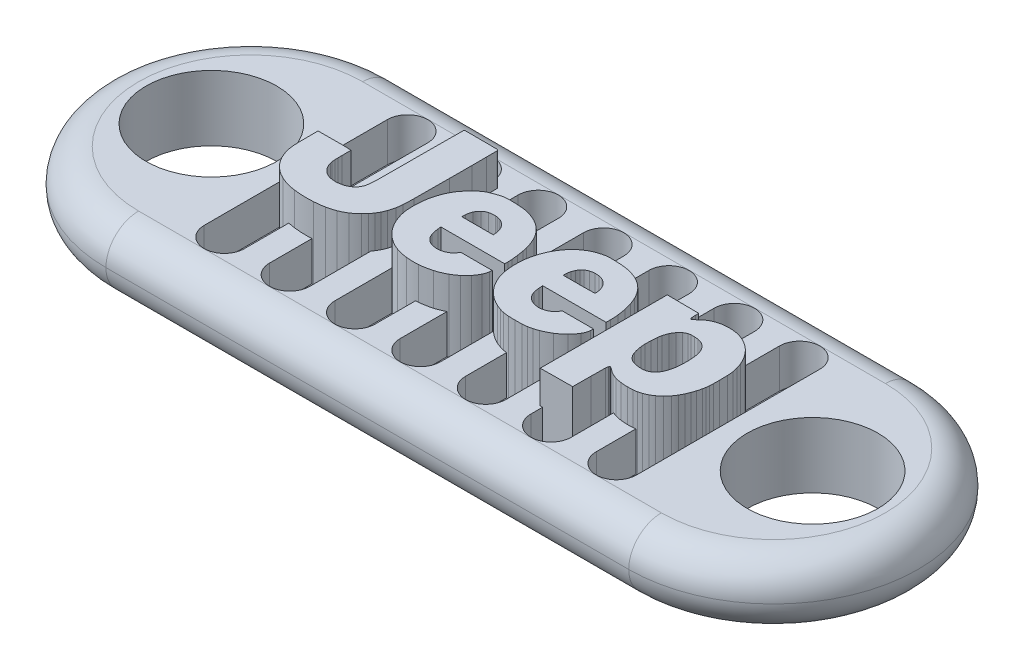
SolidWorks part; units mm, degrees
ref_plane "Front Plane" through (0, 0, 0) normal (0, 0, 1) x (1, 0, 0)
ref_plane "Top Plane" through (0, 0, 0) normal (0, 1, 0) x (1, 0, 0)
ref_plane "Right Plane" through (0, 0, 0) normal (1, 0, 0) x (0, 0, -1)
sketch "Sketch2" plane through (0, 0, 0) normal (0, 1, 0) x (1, 0, 0)
  line L0 (7.1989, 14.0654) -> (7.189, 13.0274)
  line L1 (4.2006, 7.7862) -> (4.2, 8.4725)
  line L2 (4.2, 8.4725) -> (4.01, 8.4933)
  line L3 (2.74, 8.507) -> (1.66, 8.5)
  line L4 (1.66, 8.5) -> (1.6621, 7.5)
  line L5 (9.8308, 13.2169) -> (9.8236, 14.0403)
  line L6 (17.5483, 5.7274) -> (17.5711, 5.92)
  line L7 (17.5711, 5.92) -> (16.371, 5.92)
  line L8 (16.371, 5.92) -> (15.1709, 5.92)
  line L9 (15.1709, 5.92) -> (15.0609, 5.7613)
  line L10 (12.7418, 6.59) -> (12.716, 6.84)
  line L11 (12.716, 6.84) -> (15.158, 6.84)
  line L12 (15.158, 6.84) -> (17.6, 6.84)
  line L13 (17.6, 6.84) -> (17.6, 7.0884)
  line L14 (15.2255, 8.5678) -> (15.2514, 8.32)
  line L15 (15.2514, 8.32) -> (14.0403, 8.32)
  line L16 (14.0403, 8.32) -> (12.8293, 8.32)
  line L17 (12.8293, 8.32) -> (12.8492, 8.5985)
  line L18 (25.3087, 5.7017) -> (25.3312, 5.92)
  line L19 (25.3312, 5.92) -> (24.1309, 5.92)
  line L20 (24.1309, 5.92) -> (22.9306, 5.92)
  line L21 (22.9306, 5.92) -> (22.8245, 5.7597)
  line L22 (20.5304, 6.53) -> (20.5086, 6.84)
  line L23 (20.5086, 6.84) -> (22.9343, 6.84)
  line L24 (22.9343, 6.84) -> (25.36, 6.84)
  line L25 (25.36, 6.84) -> (25.3592, 7.17)
  line L26 (22.9924, 8.3378) -> (22.6472, 8.3288)
  line L27 (21.7922, 8.32) -> (20.589, 8.32)
  line L28 (20.589, 8.32) -> (20.6101, 8.5821)
  line L29 (28.3102, 10.72) -> (28.3, 10.98)
  line L30 (28.3, 10.98) -> (27.09, 10.9906)
  line L31 (27.09, 10.9906) -> (25.88, 11.0012)
  line L32 (25.88, 11.0012) -> (25.88, 6.14)
  line L33 (25.88, 6.14) -> (25.88, 1.2788)
  line L34 (25.88, 1.2788) -> (27.11, 1.2894)
  line L35 (27.11, 1.2894) -> (28.34, 1.3)
  line L36 (28.34, 1.3) -> (28.3505, 2.69)
  arc A0 (7.2104, 14.1047) -> (7.1989, 14.0654) centre (7.2747, 14.0646) ccw
  arc A1 (7.189, 13.0274) -> (7.1809, 11.8681) centre (250.312, 10.7468) ccw
  arc A2 (7.1809, 11.8681) -> (7.1766, 10.5) centre (477.0051, 9.7009) ccw
  arc A3 (7.1686, 7.8738) -> (7.1766, 10.5) centre (-981.6143, 12.1817) ccw
  arc A4 (7.1431, 7.0983) -> (7.1686, 7.8738) centre (-6.4614, 7.9332) ccw
  arc A5 (7.0741, 6.6846) -> (7.1431, 7.0983) centre (5.129, 7.2219) ccw
  arc A6 (6.9231, 6.3707) -> (7.0741, 6.6846) centre (6.1296, 6.9455) ccw
  arc A7 (6.7206, 6.1526) -> (6.9231, 6.3707) centre (5.9288, 7.091) ccw
  arc A8 (6.4704, 5.9881) -> (6.7206, 6.1526) centre (5.9103, 7.1129) ccw
  arc A9 (6.1674, 5.8764) -> (6.4704, 5.9881) centre (5.8079, 7.3185) ccw
  arc A10 (5.8077, 5.8153) -> (6.1674, 5.8764) centre (5.5848, 8.2134) ccw
  arc A11 (5.2709, 5.8503) -> (5.8077, 5.8153) centre (5.6494, 7.5188) ccw
  arc A12 (4.806, 6.0527) -> (5.2709, 5.8503) centre (5.5716, 7.1757) ccw
  arc A13 (4.4574, 6.4056) -> (4.806, 6.0527) centre (5.5342, 7.121) ccw
  arc A14 (4.2544, 6.8741) -> (4.4574, 6.4056) centre (5.661, 7.2052) ccw
  arc A15 (4.2319, 7.0101) -> (4.2544, 6.8741) centre (5.2601, 7.1108) ccw
  arc A16 (4.2152, 7.2223) -> (4.2319, 7.0101) centre (9.7062, 7.5462) ccw
  arc A17 (4.2044, 7.4842) -> (4.2152, 7.2223) centre (11.6842, 7.6628) ccw
  arc A18 (4.2006, 7.7862) -> (4.2044, 7.4842) centre (17.3536, 7.7982) ccw
  arc A19 (4.01, 8.4933) -> (3.8862, 8.5011) centre (3.8615, 7.1337) ccw
  arc A20 (3.8862, 8.5011) -> (3.5586, 8.5059) centre (3.0695, -36.6513) ccw
  arc A21 (3.5586, 8.5059) -> (3.1675, 8.5082) centre (3.1266, -31.3811) ccw
  arc A22 (3.1675, 8.5082) -> (2.74, 8.507) centre (3.1091, -48.4008) ccw
  arc A23 (1.6621, 7.5) -> (1.6747, 6.7835) centre (24.9895, 7.5495) ccw
  arc A24 (1.6747, 6.7835) -> (1.7148, 6.3282) centre (5.8159, 6.9196) ccw
  arc A25 (1.7148, 6.3282) -> (1.7972, 5.9573) centre (4.2165, 6.6889) ccw
  arc A26 (1.7972, 5.9573) -> (1.9431, 5.5513) centre (5.8084, 7.1703) ccw
  arc A27 (1.9431, 5.5513) -> (2.5445, 4.6586) centre (4.4909, 6.6185) ccw
  arc A28 (2.5445, 4.6586) -> (3.4603, 4.0269) centre (4.7558, 6.8852) ccw
  arc A29 (3.4603, 4.0269) -> (4.6767, 3.6842) centre (5.1956, 7.8554) ccw
  arc A30 (4.6767, 3.6842) -> (6.1582, 3.6409) centre (5.6456, 11.4736) ccw
  arc A31 (6.1582, 3.6409) -> (6.9907, 3.7459) centre (5.7022, 10.6092) ccw
  arc A32 (6.9907, 3.7459) -> (7.6832, 3.945) centre (6.2851, 7.5044) ccw
  arc A33 (7.6832, 3.945) -> (8.275, 4.2519) centre (6.5112, 6.9286) ccw
  arc A34 (8.275, 4.2519) -> (8.8035, 4.68) centre (6.3657, 7.1494) ccw
  arc A35 (8.8035, 4.68) -> (9.0649, 4.9635) centre (5.9225, 7.5984) ccw
  arc A36 (9.0649, 4.9635) -> (9.2759, 5.2485) centre (6.8137, 6.8512) ccw
  arc A37 (9.2759, 5.2485) -> (9.445, 5.5478) centre (6.9753, 6.7459) ccw
  arc A38 (9.445, 5.5478) -> (9.5806, 5.8739) centre (6.6945, 6.8822) ccw
  arc A39 (9.5806, 5.8739) -> (9.7229, 6.3852) centre (5.7043, 7.2281) ccw
  arc A40 (9.7229, 6.3852) -> (9.7886, 6.8842) centre (6.473, 7.0669) ccw
  arc A41 (9.7886, 6.8842) -> (9.8139, 7.7027) centre (-7.1419, 7.8173) ccw
  arc A42 (9.8139, 7.7027) -> (9.8287, 10.3757) centre (-1087.4737, 15.1221) ccw
  arc A43 (9.8287, 10.3757) -> (9.834, 12.1155) centre (-670.8311, 13.3211) ccw
  arc A44 (9.834, 12.1155) -> (9.8308, 13.2169) centre (-107.635, 12.3238) ccw
  arc A45 (9.8236, 14.0403) -> (9.8004, 14.0956) centre (9.7443, 14.0395) ccw
  arc A46 (9.8004, 14.0956) -> (9.6933, 14.1404) centre (9.6922, 13.9874) ccw
  arc A47 (9.6933, 14.1404) -> (8.4964, 14.1469) centre (7.4182, -294.0203) ccw
  arc A48 (8.4964, 14.1469) -> (7.2905, 14.1492) centre (7.1906, -358.9684) ccw
  arc A49 (7.2905, 14.1492) -> (7.2104, 14.1047) centre (7.2905, 14.0549) ccw
  arc A50 (13.1619, 11.2374) -> (12.8973, 11.175) centre (13.6026, 8.7799) ccw
  arc A51 (12.8973, 11.175) -> (12.5834, 11.072) centre (14.4234, 5.9921) ccw
  arc A52 (12.5834, 11.072) -> (12.28, 10.9515) centre (14.4006, 6.0553) ccw
  arc A53 (12.28, 10.9515) -> (12.0498, 10.8346) centre (13.1203, 9.0112) ccw
  arc A54 (12.0498, 10.8346) -> (11.7703, 10.6326) centre (12.9708, 9.2659) ccw
  arc A55 (11.7703, 10.6326) -> (11.4368, 10.3146) centre (15.4991, 6.3875) ccw
  arc A56 (11.4368, 10.3146) -> (11.1235, 9.9628) centre (15.5736, 6.3155) ccw
  arc A57 (11.1235, 9.9628) -> (10.9043, 9.6497) centre (13.0733, 8.3647) ccw
  arc A58 (10.9043, 9.6497) -> (10.63, 9.1024) centre (14.662, 7.4236) ccw
  arc A59 (10.63, 9.1024) -> (10.4337, 8.5202) centre (14.7236, 7.398) ccw
  arc A60 (10.4337, 8.5202) -> (10.3156, 7.901) centre (14.9588, 7.3364) ccw
  arc A61 (10.3156, 7.901) -> (10.2749, 7.2434) centre (15.8503, 7.228) ccw
  arc A62 (10.2749, 7.2434) -> (10.2776, 7.0158) centre (17.8728, 7.2225) ccw
  arc A63 (10.2776, 7.0158) -> (10.2872, 6.7836) centre (18.5332, 7.2404) ccw
  arc A64 (10.2872, 6.7836) -> (10.3015, 6.5779) centre (17.6169, 7.1896) ccw
  arc A65 (10.3015, 6.5779) -> (10.3191, 6.445) centre (11.6943, 6.6944) ccw
  arc A66 (10.3191, 6.445) -> (10.5979, 5.538) centre (14.2575, 7.1592) ccw
  arc A67 (10.5979, 5.538) -> (11.0763, 4.7536) centre (13.8215, 6.966) ccw
  arc A68 (11.0763, 4.7536) -> (11.7281, 4.1363) centre (13.6881, 6.8585) ccw
  arc A69 (11.7281, 4.1363) -> (12.5159, 3.7191) centre (13.6345, 6.7841) ccw
  arc A70 (12.5159, 3.7191) -> (13.3999, 3.5094) centre (13.8504, 7.3756) ccw
  arc A71 (13.3999, 3.5094) -> (14.3622, 3.4926) centre (13.9656, 8.3644) ccw
  arc A72 (14.3622, 3.4926) -> (15.3106, 3.6649) centre (13.9644, 8.3793) ccw
  arc A73 (15.3106, 3.6649) -> (16.1535, 4.0152) centre (14.2252, 7.466) ccw
  arc A74 (16.1535, 4.0152) -> (16.6768, 4.3728) centre (14.4299, 7.0996) ccw
  arc A75 (16.6768, 4.3728) -> (17.1093, 4.8076) centre (14.7039, 6.7672) ccw
  arc A76 (17.1093, 4.8076) -> (17.4121, 5.2746) centre (15.1146, 6.4325) ccw
  arc A77 (17.4121, 5.2746) -> (17.5483, 5.7274) centre (16.196, 5.8875) ccw
  arc A78 (14.8491, 5.533) -> (15.0609, 5.7613) centre (14.156, 6.3884) ccw
  arc A79 (14.5746, 5.3635) -> (14.8491, 5.533) centre (14.0524, 6.5162) ccw
  arc A80 (14.2597, 5.2659) -> (14.5746, 5.3635) centre (14.0281, 6.5698) ccw
  arc A81 (13.9293, 5.2486) -> (14.2597, 5.2659) centre (14.0251, 6.5869) ccw
  arc A82 (13.4496, 5.3609) -> (13.9293, 5.2486) centre (14.0407, 6.8058) ccw
  arc A83 (13.0962, 5.6117) -> (13.4496, 5.3609) centre (13.8112, 6.2448) ccw
  arc A84 (12.8636, 6.0175) -> (13.0962, 5.6117) centre (13.9598, 6.3764) ccw
  arc A85 (12.7418, 6.59) -> (12.8636, 6.0175) centre (15.473, 6.8717) ccw
  arc A86 (17.6, 7.0884) -> (17.5834, 7.4317) centre (14.0423, 7.0884) ccw
  arc A87 (17.5834, 7.4317) -> (17.5284, 7.9074) centre (4.6546, 6.1783) ccw
  arc A88 (17.5284, 7.9074) -> (17.4549, 8.3866) centre (4.629, 6.1749) ccw
  arc A89 (17.4549, 8.3866) -> (17.3773, 8.7465) centre (13.1046, 7.6364) ccw
  arc A90 (17.3773, 8.7465) -> (17.0295, 9.6448) centre (13.3221, 7.6929) ccw
  arc A91 (17.0295, 9.6448) -> (16.5094, 10.3454) centre (14.512, 8.3194) ccw
  arc A92 (16.5094, 10.3454) -> (15.8083, 10.848) centre (14.5649, 8.373) ccw
  arc A93 (15.8083, 10.848) -> (14.927, 11.1621) centre (14.0994, 7.4465) ccw
  arc A94 (14.927, 11.1621) -> (14.5522, 11.2204) centre (14.2891, 8.2983) ccw
  arc A95 (14.5522, 11.2204) -> (14.0156, 11.256) centre (13.5287, -0.1487) ccw
  arc A96 (14.0156, 11.256) -> (13.487, 11.2667) centre (13.5134, -0.5075) ccw
  arc A97 (13.487, 11.2667) -> (13.1619, 11.2374) centre (13.4912, 9.4008) ccw
  arc A98 (14.7889, 9.4052) -> (14.5275, 9.5659) centre (14.1033, 8.5826) ccw
  arc A99 (15.0021, 9.1732) -> (14.7889, 9.4052) centre (14.0273, 8.4914) ccw
  arc A100 (15.1515, 8.887) -> (15.0021, 9.1732) centre (13.9765, 8.4559) ccw
  arc A101 (15.2255, 8.5678) -> (15.1515, 8.887) centre (13.9053, 8.4298) ccw
  arc A102 (12.9612, 9.0617) -> (12.8492, 8.5985) centre (14.2883, 8.4955) ccw
  arc A103 (13.2133, 9.4104) -> (12.9612, 9.0617) centre (13.8569, 8.6795) ccw
  arc A104 (13.5899, 9.6151) -> (13.2133, 9.4104) centre (13.8512, 8.686) ccw
  arc A105 (14.06, 9.6647) -> (13.5899, 9.6151) centre (13.9702, 8.2628) ccw
  arc A106 (14.181, 9.6519) -> (14.06, 9.6647) centre (13.9657, 8.1932) ccw
  arc A107 (14.3128, 9.6283) -> (14.181, 9.6519) centre (13.8648, 7.5089) ccw
  arc A108 (14.4358, 9.5982) -> (14.3128, 9.6283) centre (13.8958, 7.6557) ccw
  arc A109 (14.5275, 9.5659) -> (14.4358, 9.5982) centre (14.2445, 8.9098) ccw
  arc A110 (20.9266, 11.238) -> (20.1553, 11.0011) centre (21.5212, 7.9293) ccw
  arc A111 (20.1553, 11.0011) -> (19.4846, 10.5913) centre (21.3875, 8.23) ccw
  arc A112 (19.4846, 10.5913) -> (18.9239, 10.0095) centre (21.5079, 8.0805) ccw
  arc A113 (18.9239, 10.0095) -> (18.4776, 9.2645) centre (22.3574, 7.4464) ccw
  arc A114 (18.4776, 9.2645) -> (18.2819, 8.7757) centre (22.6335, 7.317) ccw
  arc A115 (18.2819, 8.7757) -> (18.1459, 8.273) centre (22.4487, 7.379) ccw
  arc A116 (18.1459, 8.273) -> (18.0664, 7.7395) centre (22.7837, 7.3094) ccw
  arc A117 (18.0664, 7.7395) -> (18.04, 7.1584) centre (24.4395, 7.1584) ccw
  arc A118 (18.04, 7.1584) -> (18.1753, 6.0867) centre (22.3513, 7.1584) ccw
  arc A119 (18.1753, 6.0867) -> (18.5723, 5.1399) centre (21.5971, 6.9648) ccw
  arc A120 (18.5723, 5.1399) -> (19.2115, 4.3708) centre (21.4259, 6.8616) ccw
  arc A121 (19.2115, 4.3708) -> (20.0551, 3.8184) centre (21.4993, 6.9441) ccw
  arc A122 (20.0551, 3.8184) -> (20.4487, 3.6591) centre (21.904, 7.8201) ccw
  arc A123 (20.4487, 3.6591) -> (20.8016, 3.5648) centre (21.2505, 5.9516) ccw
  arc A124 (20.8016, 3.5648) -> (21.1986, 3.5167) centre (21.367, 6.5708) ccw
  arc A125 (21.1986, 3.5167) -> (21.74, 3.5015) centre (21.75, 13.5192) ccw
  arc A126 (21.74, 3.5015) -> (22.2573, 3.5125) centre (21.7516, 15.175) ccw
  arc A127 (22.2573, 3.5125) -> (22.6374, 3.5495) centre (22.1035, 7.0606) ccw
  arc A128 (22.6374, 3.5495) -> (22.9758, 3.6229) centre (22.2204, 6.2917) ccw
  arc A129 (22.9758, 3.6229) -> (23.3535, 3.7469) centre (21.6698, 8.237) ccw
  arc A130 (23.3535, 3.7469) -> (24.0723, 4.1056) centre (21.9963, 7.3661) ccw
  arc A131 (24.0723, 4.1056) -> (24.6889, 4.6003) centre (22.1239, 7.1657) ccw
  arc A132 (24.6889, 4.6003) -> (25.1261, 5.1577) centre (22.6033, 6.6862) ccw
  arc A133 (25.1261, 5.1577) -> (25.3087, 5.7017) centre (24.0065, 5.8361) ccw
  arc A134 (22.6374, 5.549) -> (22.8245, 5.7597) centre (21.992, 6.3107) ccw
  arc A135 (22.3871, 5.383) -> (22.6374, 5.549) centre (21.8085, 6.5272) ccw
  arc A136 (22.0981, 5.2762) -> (22.3871, 5.383) centre (21.7779, 6.5876) ccw
  arc A137 (21.797, 5.24) -> (22.0981, 5.2762) centre (21.797, 6.5097) ccw
  arc A138 (21.7059, 5.2457) -> (21.797, 5.24) centre (21.797, 5.9656) ccw
  arc A139 (21.5851, 5.2643) -> (21.7059, 5.2457) centre (21.9924, 7.5108) ccw
  arc A140 (21.4568, 5.2911) -> (21.5851, 5.2643) centre (22.0284, 7.7092) ccw
  arc A141 (21.3404, 5.3228) -> (21.4568, 5.2911) centre (21.8685, 7.0326) ccw
  arc A142 (21.0128, 5.4854) -> (21.3404, 5.3228) centre (21.6765, 6.4112) ccw
  arc A143 (20.7672, 5.7388) -> (21.0128, 5.4854) centre (21.5905, 6.2912) ccw
  arc A144 (20.6068, 6.0873) -> (20.7672, 5.7388) centre (21.7685, 6.4106) ccw
  arc A145 (20.5304, 6.53) -> (20.6068, 6.0873) centre (22.7627, 6.6873) ccw
  arc A146 (25.3592, 7.17) -> (25.3246, 7.7853) centre (19.6274, 7.1564) ccw
  arc A147 (25.3246, 7.7853) -> (25.2241, 8.405) centre (19.1887, 7.108) ccw
  arc A148 (25.2241, 8.405) -> (25.0654, 8.9925) centre (19.5279, 7.1809) ccw
  arc A149 (25.0654, 8.9925) -> (24.8562, 9.511) centre (21.1143, 7.6999) ccw
  arc A150 (24.8562, 9.511) -> (24.4759, 10.1211) centre (21.8143, 8.0387) ccw
  arc A151 (24.4759, 10.1211) -> (23.9958, 10.5942) centre (22.4103, 8.5049) ccw
  arc A152 (23.9958, 10.5942) -> (23.4009, 10.9375) centre (22.3413, 8.4141) ccw
  arc A153 (23.4009, 10.9375) -> (22.6802, 11.1623) centre (21.8617, 7.272) ccw
  arc A154 (22.6802, 11.1623) -> (22.2898, 11.2213) centre (21.9741, 7.8063) ccw
  arc A155 (22.2898, 11.2213) -> (21.7623, 11.257) centre (21.2976, 0.4878) ccw
  arc A156 (21.7623, 11.257) -> (21.2479, 11.2672) centre (21.2855, 0.2072) ccw
  arc A157 (21.2479, 11.2672) -> (20.9266, 11.238) centre (21.2542, 9.4149) ccw
  arc A158 (22.584, 9.3827) -> (22.3431, 9.5402) centre (21.8324, 8.4964) ccw
  arc A159 (22.7765, 9.1719) -> (22.584, 9.3827) centre (21.8565, 8.5248) ccw
  arc A160 (22.9145, 8.9131) -> (22.7765, 9.1719) centre (21.8003, 8.4853) ccw
  arc A161 (22.9946, 8.6139) -> (22.9145, 8.9131) centre (21.5339, 8.383) ccw
  arc A162 (23.0075, 8.5221) -> (22.9946, 8.6139) centre (20.4172, 8.2066) ccw
  arc A163 (23.0154, 8.4399) -> (23.0075, 8.5221) centre (21.3706, 8.3227) ccw
  arc A164 (23.0191, 8.3717) -> (23.0154, 8.4399) centre (21.0658, 8.301) ccw
  arc A165 (23.0134, 8.35) -> (23.0191, 8.3717) centre (22.9799, 8.3703) ccw
  arc A166 (22.9924, 8.3378) -> (23.0134, 8.35) centre (22.9917, 8.3632) ccw
  arc A167 (22.2547, 8.3222) -> (22.6472, 8.3288) centre (22.0139, 34.1109) ccw
  arc A168 (21.7922, 8.32) -> (22.2547, 8.3222) centre (21.7922, 57.847) ccw
  arc A169 (20.6569, 8.8437) -> (20.6101, 8.5821) centre (21.9786, 8.4723) ccw
  arc A170 (20.7538, 9.0972) -> (20.6569, 8.8437) centre (22.0915, 8.4406) ccw
  arc A171 (20.8868, 9.3129) -> (20.7538, 9.0972) centre (21.9359, 8.517) ccw
  arc A172 (21.0414, 9.461) -> (20.8868, 9.3129) centre (21.4293, 8.9013) ccw
  arc A173 (21.331, 9.6026) -> (21.0414, 9.461) centre (21.651, 8.5814) ccw
  arc A174 (21.6727, 9.6656) -> (21.331, 9.6026) centre (21.7598, 8.234) ccw
  arc A175 (22.0242, 9.6448) -> (21.6727, 9.6656) centre (21.7622, 8.1947) ccw
  arc A176 (22.3431, 9.5402) -> (22.0242, 9.6448) centre (21.8076, 8.4456) ccw
  arc A177 (30.0216, 11.1555) -> (29.6294, 11.071) centre (30.4501, 8.2139) ccw
  arc A178 (29.6294, 11.071) -> (29.2869, 10.9391) centre (30.2066, 9.0619) ccw
  arc A179 (29.2869, 10.9391) -> (28.976, 10.7508) centre (30.1861, 9.1035) ccw
  arc A180 (28.976, 10.7508) -> (28.6788, 10.4977) centre (30.5832, 8.563) ccw
  arc A181 (28.5906, 10.4143) -> (28.6788, 10.4977) centre (26.5721, 12.638) ccw
  arc A182 (28.5085, 10.3439) -> (28.5906, 10.4143) centre (27.3186, 11.8156) ccw
  arc A183 (28.4382, 10.2895) -> (28.5085, 10.3439) centre (27.158, 12.0142) ccw
  arc A184 (28.4096, 10.28) -> (28.4382, 10.2895) centre (28.4096, 10.328) ccw
  arc A185 (28.3696, 10.3037) -> (28.4096, 10.28) centre (28.4096, 10.3255) ccw
  arc A186 (28.3419, 10.3773) -> (28.3696, 10.3037) centre (28.6196, 10.4401) ccw
  arc A187 (28.3225, 10.5063) -> (28.3419, 10.3773) centre (29.2111, 10.5736) ccw
  arc A188 (28.3102, 10.72) -> (28.3225, 10.5063) centre (34.2064, 10.952) ccw
  arc A189 (28.3622, 3.7777) -> (28.3505, 2.69) centre (199.4795, 1.3949) ccw
  arc A190 (28.3963, 4.0087) -> (28.3622, 3.7777) centre (29.2468, 3.7653) ccw
  arc A191 (28.4899, 4.0504) -> (28.3963, 4.0087) centre (28.4606, 3.9903) ccw
  arc A192 (28.7007, 3.9139) -> (28.4899, 4.0504) centre (28.0303, 3.1094) ccw
  arc A193 (28.7007, 3.9139) -> (29.0511, 3.6791) centre (29.9999, 5.473) ccw
  arc A194 (29.0511, 3.6791) -> (29.4507, 3.515) centre (30.0934, 5.6497) ccw
  arc A195 (29.4507, 3.515) -> (29.915, 3.4181) centre (30.2405, 6.1384) ccw
  arc A196 (29.915, 3.4181) -> (30.46, 3.3843) centre (30.4835, 8.1697) ccw
  arc A197 (30.46, 3.3843) -> (30.8641, 3.3963) centre (30.4886, 9.2193) ccw
  arc A198 (30.8641, 3.3963) -> (31.1741, 3.4393) centre (30.7268, 5.5256) ccw
  arc A199 (31.1741, 3.4393) -> (31.4635, 3.5253) centre (30.7663, 5.3417) ccw
  arc A200 (31.4635, 3.5253) -> (31.8, 3.6716) centre (29.9553, 7.4544) ccw
  arc A201 (31.8, 3.6716) -> (32.1099, 3.8635) centre (31.0062, 5.2993) ccw
  arc A202 (32.1099, 3.8635) -> (32.4393, 4.1494) centre (29.8684, 6.7795) ccw
  arc A203 (32.4393, 4.1494) -> (32.7378, 4.4777) centre (29.8026, 6.8468) ccw
  arc A204 (32.7378, 4.4777) -> (32.9544, 4.8) centre (31.0087, 5.8734) ccw
  arc A205 (32.9544, 4.8) -> (33.1123, 5.1125) centre (28.7167, 7.1378) ccw
  arc A206 (33.1123, 5.1125) -> (33.2484, 5.4377) centre (28.5949, 7.1939) ccw
  arc A207 (33.2484, 5.4377) -> (33.3615, 5.7727) centre (28.5655, 7.205) ccw
  arc A208 (33.3615, 5.7727) -> (33.4506, 6.1147) centre (28.5774, 7.2015) ccw
  arc A209 (33.4506, 6.1147) -> (33.4954, 6.3541) centre (29.9644, 6.8922) ccw
  arc A210 (33.4954, 6.3541) -> (33.5209, 6.5831) centre (30.6648, 6.7854) ccw
  arc A211 (33.5209, 6.5831) -> (33.5335, 6.8738) centre (28.2601, 6.9558) ccw
  arc A212 (33.5335, 6.8738) -> (33.5374, 7.34) centre (1.3645, 7.3741) ccw
  arc A213 (33.5374, 7.34) -> (33.5236, 7.9743) centre (19.6169, 7.3548) ccw
  arc A214 (33.5236, 7.9743) -> (33.4769, 8.4402) centre (29.2899, 7.7857) ccw
  arc A215 (33.4769, 8.4402) -> (33.3864, 8.8411) centre (30.4457, 7.9664) ccw
  arc A216 (33.3864, 8.8411) -> (33.2371, 9.2608) centre (29.3323, 7.6352) ccw
  arc A217 (33.2371, 9.2608) -> (32.6996, 10.1421) centre (30.1141, 7.9607) ccw
  arc A218 (32.6996, 10.1421) -> (31.9365, 10.7864) centre (30.427, 8.2246) ccw
  arc A219 (31.9365, 10.7864) -> (31.0158, 11.1336) centre (30.4762, 8.3082) ccw
  arc A220 (31.0158, 11.1336) -> (30.0216, 11.1555) centre (30.4536, 8.1899) ccw
  arc A221 (30.5878, 8.9478) -> (30.2053, 9.1806) centre (29.8493, 8.1651) ccw
  arc A222 (30.8539, 8.5742) -> (30.5878, 8.9478) centre (29.7774, 8.089) ccw
  arc A223 (31.0071, 8.0342) -> (30.8539, 8.5742) centre (29.1073, 7.7869) ccw
  arc A224 (31.053, 7.3) -> (31.0071, 8.0342) centre (25.5624, 7.3256) ccw
  arc A225 (31.0192, 6.6478) -> (31.053, 7.3) centre (24.1225, 7.3324) ccw
  arc A226 (30.9211, 6.1273) -> (31.0192, 6.6478) centre (27.9971, 6.9478) ccw
  arc A227 (30.7566, 5.7182) -> (30.9211, 6.1273) centre (28.9638, 6.6765) ccw
  arc A228 (30.5215, 5.4061) -> (30.7566, 5.7182) centre (29.6387, 6.3158) ccw
  arc A229 (30.339, 5.264) -> (30.5215, 5.4061) centre (29.7784, 6.1718) ccw
  arc A230 (30.1403, 5.1743) -> (30.339, 5.264) centre (29.8953, 5.9825) ccw
  arc A231 (29.9039, 5.131) -> (30.1403, 5.1743) centre (29.831, 6.1945) ccw
  arc A232 (29.6056, 5.1284) -> (29.9039, 5.131) centre (29.7336, 7.6166) ccw
  arc A233 (29.0784, 5.2345) -> (29.6056, 5.1284) centre (29.6998, 6.9594) ccw
  arc A234 (28.7023, 5.4852) -> (29.0784, 5.2345) centre (29.3979, 6.1214) ccw
  arc A235 (28.455, 5.909) -> (28.7023, 5.4852) centre (29.5598, 6.2695) ccw
  arc A236 (28.3146, 6.54) -> (28.455, 5.909) centre (31.6486, 6.9511) ccw
  arc A237 (28.2895, 6.9043) -> (28.3146, 6.54) centre (31.6739, 6.9542) ccw
  arc A238 (28.2958, 7.3568) -> (28.2895, 6.9043) centre (36.1863, 7.0207) ccw
  arc A239 (28.3268, 7.7946) -> (28.2958, 7.3568) centre (36.0636, 7.026) ccw
  arc A240 (28.3811, 8.1025) -> (28.3268, 7.7946) centre (30.3901, 7.5896) ccw
  arc A241 (28.5204, 8.499) -> (28.3811, 8.1025) centre (30.7021, 7.51) ccw
  arc A242 (28.7182, 8.8295) -> (28.5204, 8.499) centre (30.0664, 7.7981) ccw
  arc A243 (28.9617, 9.0751) -> (28.7182, 8.8295) centre (29.7935, 8.0069) ccw
  arc A244 (29.2364, 9.2205) -> (28.9617, 9.0751) centre (29.5102, 8.3708) ccw
  arc A245 (29.437, 9.259) -> (29.2364, 9.2205) centre (29.494, 8.4208) ccw
  arc A246 (29.7061, 9.2626) -> (29.437, 9.259) centre (29.6048, 6.7953) ccw
  arc A247 (29.9817, 9.2362) -> (29.7061, 9.2626) centre (29.6018, 6.7225) ccw
  arc A248 (30.2053, 9.1806) -> (29.9817, 9.2362) centre (29.7975, 8.0175) ccw
extrude "Boss-Extrude1" add sketch "Sketch2" along normal blind 2.5
sketch "Sketch3" plane through (0, 0, 0) normal (0, -1, 0) x (1, 0, 0)
  line L0 (1.6656, -7.1417) -> (33.5341, -7.6572) construction
  line L1 (-2.4001, -7.3995) -> (37.5999, -7.3995) construction
  line L2 (-2.4001, 3.6706) -> (37.5999, 3.6706)
  line L3 (-2.4001, -18.4695) -> (37.5999, -18.4695)
  line L4 (0, 0) -> (7.3825, 0) construction
  line L5 (17.5999, -14.4097) -> (17.5999, -0.3893) construction
  line L6 (16.057, -14.4097) -> (16.057, -10.7065)
  line L7 (19.1428, -14.4097) -> (19.1428, -10.2724)
  line L8 (24.1428, -14.4097) -> (24.1428, -10.474)
  line L9 (21.057, -14.4097) -> (21.057, -11.2567)
  line L10 (22.5999, -14.4097) -> (22.5999, -0.3893) construction
  line L11 (29.1428, -14.4097) -> (29.1428, -10.8612)
  line L12 (26.057, -14.4097) -> (26.057, -10.9996)
  line L13 (27.5999, -14.4097) -> (27.5999, -0.3893) construction
  line L14 (34.1428, -14.4097) -> (34.1428, -0.3893)
  line L15 (31.057, -14.4097) -> (31.057, -11.1254)
  line L16 (32.5999, -14.4097) -> (32.5999, -0.3893) construction
  line L17 (12.5999, -14.4097) -> (12.5999, -0.3893) construction
  line L18 (11.057, -14.4097) -> (11.057, -9.878)
  line L19 (14.1428, -14.4097) -> (14.1428, -11.2499)
  line L20 (7.5999, -14.4097) -> (7.5999, -0.3893) construction
  line L21 (6.057, -14.4097) -> (6.057, -5.8516)
  line L22 (9.1428, -14.4097) -> (9.1428, -14.144)
  line L23 (2.5999, -14.4097) -> (2.5999, -0.3893) construction
  line L24 (1.057, -14.4097) -> (1.057, -0.3893)
  line L25 (4.1428, -14.4097) -> (4.1428, -8.4787)
  line L26 (28.3102, -10.72) -> (28.3, -10.98) construction
  line L27 (28.3, -10.98) -> (25.88, -11.0012) construction
  line L29 (4.1428, -3.786) -> (4.1428, -0.3893)
  line L30 (6.057, -3.6349) -> (6.057, -0.3893)
  line L31 (9.1428, -5.0605) -> (9.1428, -0.3893)
  line L32 (7.189, -13.0274) -> (7.1989, -14.0654)
  line L33 (4.2, -8.4725) -> (4.2006, -7.7862)
  line L34 (4.01, -8.4933) -> (4.2, -8.4725)
  line L35 (1.66, -8.5) -> (2.74, -8.507)
  line L36 (1.6621, -7.5) -> (1.66, -8.5)
  line L37 (9.8236, -14.0402) -> (9.8308, -13.2169)
  line L38 (7.189, -13.0274) -> (7.1989, -14.0654)
  line L40 (4.01, -8.4933) -> (4.1428, -8.4787)
  line L41 (1.66, -8.5) -> (2.74, -8.507)
  line L42 (1.6621, -7.5) -> (1.66, -8.5)
  line L44 (25.88, -1.2788) -> (28.34, -1.3) construction
  line L45 (28.34, -1.3) -> (28.3505, -2.69) construction
  line L47 (25.3312, -5.92) -> (22.9306, -5.92) construction
  line L48 (22.9306, -5.92) -> (22.8245, -5.7597) construction
  line L50 (20.5086, -6.84) -> (25.36, -6.84) construction
  line L51 (11.057, -4.7778) -> (11.057, -0.3893)
  line L52 (16.057, -6.84) -> (16.057, -5.92)
  line L53 (16.057, -6.84) -> (17.6, -6.84)
  line L54 (12.8492, -8.5985) -> (12.8293, -8.32) construction
  line L56 (12.8293, -8.32) -> (15.2514, -8.32) construction
  line L57 (12.8492, -8.5985) -> (12.8293, -8.32)
  line L59 (12.8293, -8.32) -> (14.1428, -8.32)
  line L60 (14.1428, -9.6571) -> (14.1428, -8.32)
  line L61 (14.1428, -6.84) -> (14.1428, -5.2504)
  line L62 (16.057, -3.963) -> (16.057, -0.3893)
  line L64 (17.5483, -5.7274) -> (17.5711, -5.92) construction
  line L65 (17.5711, -5.92) -> (15.1709, -5.92) construction
  line L67 (12.7418, -6.59) -> (12.716, -6.84) construction
  line L68 (12.716, -6.84) -> (17.6, -6.84) construction
  line L69 (17.6, -6.84) -> (17.6, -7.0884) construction
  line L70 (28.3102, -10.72) -> (28.3, -10.98)
  line L71 (28.3, -10.98) -> (26.057, -10.9996)
  line L73 (26.057, -1.2804) -> (28.34, -1.3)
  line L74 (28.34, -1.3) -> (28.3505, -2.69)
  line L76 (24.1428, -5.92) -> (22.9306, -5.92)
  line L77 (22.9306, -5.92) -> (22.8245, -5.7597)
  line L79 (21.057, -6.84) -> (24.1428, -6.84)
  line L81 (17.5483, -5.7274) -> (17.5711, -5.92)
  line L82 (17.5711, -5.92) -> (16.057, -5.92)
  line L84 (12.7418, -6.59) -> (12.716, -6.84)
  line L85 (12.716, -6.84) -> (14.1428, -6.84)
  line L86 (17.6, -6.84) -> (17.6, -7.0884)
  line L87 (14.1428, -3.4797) -> (14.1428, -0.3893)
  line L88 (19.1428, -4.4337) -> (19.1428, -0.3893)
  line L89 (21.057, -3.5278) -> (21.057, -0.3893)
  line L90 (24.1428, -4.1516) -> (24.1428, -0.3893)
  line L92 (24.1428, -6.84) -> (24.1428, -5.92)
  line L93 (21.057, -6.84) -> (21.057, -5.4553)
  line L94 (22.6472, -8.3288) -> (22.9924, -8.3378) construction
  line L95 (20.589, -8.32) -> (21.7922, -8.32) construction
  line L97 (22.6472, -8.3288) -> (22.9924, -8.3378)
  line L98 (21.057, -8.32) -> (21.7922, -8.32)
  line L99 (21.057, -9.4716) -> (21.057, -8.32)
  line L100 (29.1428, -9.1844) -> (29.1428, -5.2127)
  line L101 (29.1428, -3.6332) -> (29.1428, -0.3893)
  line L102 (26.057, -1.2804) -> (26.057, -0.3893)
  line L103 (31.057, -3.4176) -> (31.057, -0.3893)
  arc A0 (1.6747, -6.7835) -> (1.6621, -7.5) centre (24.9895, -7.5495) ccw construction
  arc A1 (33.5236, -7.9743) -> (33.5374, -7.34) centre (19.6169, -7.3548) ccw construction
  arc A2 (-2.4001, 3.6706) -> (-2.4001, -18.4695) centre (-2.4001, -7.3995) ccw
  arc A3 (37.5999, -18.4695) -> (37.5999, 3.6706) centre (37.5999, -7.3995) ccw
  circle A4 centre (-5.4001, -7.3995) radius 5
  circle A5 centre (40.5999, -7.3995) radius 5
  arc A6 (16.057, -14.4097) -> (19.1428, -14.4097) centre (17.5999, -14.4097) ccw
  arc A7 (19.1428, -0.3893) -> (16.057, -0.3893) centre (17.5999, -0.3893) ccw
  arc A8 (21.057, -14.4097) -> (24.1428, -14.4097) centre (22.5999, -14.4097) ccw
  arc A9 (24.1428, -0.3893) -> (21.057, -0.3893) centre (22.5999, -0.3893) ccw
  arc A10 (26.057, -14.4097) -> (29.1428, -14.4097) centre (27.5999, -14.4097) ccw
  arc A11 (29.1428, -0.3893) -> (26.057, -0.3893) centre (27.5999, -0.3893) ccw
  arc A12 (31.057, -14.4097) -> (34.1428, -14.4097) centre (32.5999, -14.4097) ccw
  arc A13 (34.1428, -0.3893) -> (31.057, -0.3893) centre (32.5999, -0.3893) ccw
  arc A14 (11.057, -14.4097) -> (14.1428, -14.4097) centre (12.5999, -14.4097) ccw
  arc A15 (14.1428, -0.3893) -> (11.057, -0.3893) centre (12.5999, -0.3893) ccw
  arc A16 (6.057, -14.4097) -> (9.1428, -14.4097) centre (7.5999, -14.4097) ccw
  arc A17 (9.1428, -0.3893) -> (6.057, -0.3893) centre (7.5999, -0.3893) ccw
  arc A18 (1.057, -14.4097) -> (4.1428, -14.4097) centre (2.5999, -14.4097) ccw
  arc A19 (4.1428, -0.3893) -> (1.057, -0.3893) centre (2.5999, -0.3893) ccw
  arc A26 (28.976, -10.7508) -> (29.2869, -10.9391) centre (30.1861, -9.1035) ccw construction
  arc A27 (28.6788, -10.4977) -> (28.976, -10.7508) centre (30.5832, -8.563) ccw construction
  arc A28 (28.6788, -10.4977) -> (28.5906, -10.4143) centre (26.5721, -12.638) ccw construction
  arc A29 (28.5906, -10.4143) -> (28.5085, -10.3439) centre (27.3186, -11.8156) ccw construction
  arc A30 (28.5085, -10.3439) -> (28.4382, -10.2895) centre (27.158, -12.0142) ccw construction
  arc A31 (28.4382, -10.2895) -> (28.4096, -10.28) centre (28.4096, -10.328) ccw construction
  arc A32 (28.4096, -10.28) -> (28.3696, -10.3037) centre (28.4096, -10.3255) ccw construction
  arc A33 (28.3696, -10.3037) -> (28.3419, -10.3773) centre (28.6196, -10.4401) ccw construction
  arc A34 (28.3419, -10.3773) -> (28.3225, -10.5063) centre (29.2111, -10.5736) ccw construction
  arc A35 (28.3225, -10.5063) -> (28.3102, -10.72) centre (34.2064, -10.952) ccw construction
  arc A36 (28.3505, -2.69) -> (28.3622, -3.7777) centre (199.4795, -1.3949) ccw construction
  arc A37 (28.3622, -3.7777) -> (28.3963, -4.0087) centre (29.2468, -3.7653) ccw construction
  arc A38 (28.3963, -4.0087) -> (28.4899, -4.0504) centre (28.4606, -3.9903) ccw construction
  arc A39 (28.4899, -4.0504) -> (28.7007, -3.9139) centre (28.0303, -3.1094) ccw construction
  arc A40 (29.0511, -3.6791) -> (28.7007, -3.9139) centre (29.9999, -5.473) ccw construction
  arc A41 (29.4507, -3.515) -> (29.0511, -3.6791) centre (30.0934, -5.6497) ccw construction
  arc A45 (31.1741, -3.4393) -> (30.8641, -3.3963) centre (30.7268, -5.5256) ccw construction
  arc A46 (31.4635, -3.5253) -> (31.1741, -3.4393) centre (30.7663, -5.3417) ccw construction
  arc A47 (31.8, -3.6716) -> (31.4635, -3.5253) centre (29.9553, -7.4544) ccw construction
  arc A48 (32.1099, -3.8635) -> (31.8, -3.6716) centre (31.0062, -5.2993) ccw construction
  arc A49 (32.4393, -4.1494) -> (32.1099, -3.8635) centre (29.8684, -6.7795) ccw construction
  arc A50 (32.7378, -4.4777) -> (32.4393, -4.1494) centre (29.8026, -6.8468) ccw construction
  arc A51 (32.9544, -4.8) -> (32.7378, -4.4777) centre (31.0087, -5.8734) ccw construction
  arc A52 (33.1123, -5.1125) -> (32.9544, -4.8) centre (28.7167, -7.1378) ccw construction
  arc A53 (33.2484, -5.4377) -> (33.1123, -5.1125) centre (28.5949, -7.1939) ccw construction
  arc A54 (33.3615, -5.7727) -> (33.2484, -5.4377) centre (28.5655, -7.205) ccw construction
  arc A55 (33.4506, -6.1147) -> (33.3615, -5.7727) centre (28.5774, -7.2015) ccw construction
  arc A56 (33.4954, -6.3541) -> (33.4506, -6.1147) centre (29.9644, -6.8922) ccw construction
  arc A57 (33.5209, -6.5831) -> (33.4954, -6.3541) centre (30.6648, -6.7854) ccw construction
  arc A58 (33.5335, -6.8738) -> (33.5209, -6.5831) centre (28.2601, -6.9558) ccw construction
  arc A59 (33.5374, -7.34) -> (33.5335, -6.8738) centre (1.3645, -7.3741) ccw construction
  arc A60 (33.4769, -8.4402) -> (33.5236, -7.9743) centre (29.2899, -7.7857) ccw construction
  arc A61 (33.3864, -8.8411) -> (33.4769, -8.4402) centre (30.4457, -7.9664) ccw construction
  arc A62 (33.2371, -9.2608) -> (33.3864, -8.8411) centre (29.3323, -7.6352) ccw construction
  arc A63 (32.6996, -10.1421) -> (33.2371, -9.2608) centre (30.1141, -7.9607) ccw construction
  arc A64 (31.9365, -10.7864) -> (32.6996, -10.1421) centre (30.427, -8.2246) ccw construction
  arc A65 (31.0158, -11.1336) -> (31.9365, -10.7864) centre (30.4762, -8.3082) ccw construction
  arc A66 (20.9266, -11.238) -> (21.2479, -11.2672) centre (21.2542, -9.4149) ccw construction
  arc A69 (18.9239, -10.0095) -> (19.4846, -10.5913) centre (21.5079, -8.0805) ccw construction
  arc A70 (18.4776, -9.2645) -> (18.9239, -10.0095) centre (22.3574, -7.4464) ccw construction
  arc A71 (18.2819, -8.7757) -> (18.4776, -9.2645) centre (22.6335, -7.317) ccw construction
  arc A72 (18.1459, -8.273) -> (18.2819, -8.7757) centre (22.4487, -7.379) ccw construction
  arc A73 (7.2104, -14.1047) -> (7.2905, -14.1492) centre (7.2905, -14.0549) ccw
  arc A74 (7.1989, -14.0654) -> (7.2104, -14.1047) centre (7.2747, -14.0646) ccw
  arc A75 (7.1809, -11.8681) -> (7.189, -13.0274) centre (250.312, -10.7468) ccw
  arc A76 (7.1766, -10.5) -> (7.1809, -11.8681) centre (477.0051, -9.7009) ccw
  arc A77 (7.1766, -10.5) -> (7.1686, -7.8738) centre (-981.6143, -12.1817) ccw
  arc A78 (7.1686, -7.8738) -> (7.1431, -7.0983) centre (-6.4614, -7.9332) ccw
  arc A79 (7.1431, -7.0983) -> (7.0741, -6.6846) centre (5.129, -7.2219) ccw
  arc A80 (7.0741, -6.6846) -> (6.9231, -6.3707) centre (6.1296, -6.9455) ccw
  arc A81 (6.9231, -6.3707) -> (6.7206, -6.1526) centre (5.9288, -7.091) ccw
  arc A82 (6.7206, -6.1526) -> (6.4704, -5.9881) centre (5.9103, -7.1129) ccw
  arc A83 (6.4704, -5.9881) -> (6.1674, -5.8764) centre (5.8079, -7.3185) ccw
  arc A84 (6.1674, -5.8764) -> (5.8077, -5.8153) centre (5.5848, -8.2134) ccw
  arc A85 (5.8077, -5.8153) -> (5.2709, -5.8503) centre (5.6494, -7.5188) ccw
  arc A86 (5.2709, -5.8503) -> (4.806, -6.0527) centre (5.5716, -7.1757) ccw
  arc A87 (4.806, -6.0527) -> (4.4574, -6.4056) centre (5.5342, -7.121) ccw
  arc A88 (4.4574, -6.4056) -> (4.2544, -6.8741) centre (5.661, -7.2052) ccw
  arc A89 (4.2544, -6.8741) -> (4.2319, -7.0101) centre (5.2601, -7.1108) ccw
  arc A90 (4.2319, -7.0101) -> (4.2152, -7.2223) centre (9.7062, -7.5462) ccw
  arc A91 (4.2152, -7.2223) -> (4.2044, -7.4842) centre (11.6842, -7.6628) ccw
  arc A92 (4.2044, -7.4842) -> (4.2006, -7.7862) centre (17.3536, -7.7982) ccw
  arc A93 (3.8862, -8.5011) -> (4.01, -8.4933) centre (3.8615, -7.1337) ccw
  arc A94 (3.5586, -8.5059) -> (3.8862, -8.5011) centre (3.0695, 36.6513) ccw
  arc A95 (3.1675, -8.5082) -> (3.5586, -8.5059) centre (3.1266, 31.3811) ccw
  arc A96 (2.74, -8.507) -> (3.1675, -8.5082) centre (3.1091, 48.4008) ccw
  arc A97 (1.6747, -6.7835) -> (1.6621, -7.5) centre (24.9895, -7.5495) ccw
  arc A98 (1.7148, -6.3282) -> (1.6747, -6.7835) centre (5.8159, -6.9196) ccw
  arc A99 (1.7972, -5.9573) -> (1.7148, -6.3282) centre (4.2165, -6.6889) ccw
  arc A100 (1.9431, -5.5513) -> (1.7972, -5.9573) centre (5.8084, -7.1703) ccw
  arc A101 (2.5445, -4.6586) -> (1.9431, -5.5513) centre (4.4909, -6.6185) ccw
  arc A102 (3.4603, -4.0269) -> (2.5445, -4.6586) centre (4.7558, -6.8852) ccw
  arc A103 (4.6767, -3.6842) -> (3.4603, -4.0269) centre (5.1956, -7.8554) ccw
  arc A104 (6.1582, -3.6409) -> (4.6767, -3.6842) centre (5.6456, -11.4736) ccw
  arc A105 (6.9907, -3.7459) -> (6.1582, -3.6409) centre (5.7022, -10.6092) ccw
  arc A106 (7.6832, -3.945) -> (6.9907, -3.7459) centre (6.2851, -7.5044) ccw
  arc A107 (8.275, -4.2519) -> (7.6832, -3.945) centre (6.5112, -6.9286) ccw
  arc A108 (8.8035, -4.68) -> (8.275, -4.2519) centre (6.3657, -7.1494) ccw
  arc A109 (9.0649, -4.9635) -> (8.8035, -4.68) centre (5.9225, -7.5984) ccw
  arc A110 (9.2759, -5.2485) -> (9.0649, -4.9635) centre (6.8137, -6.8512) ccw
  arc A111 (9.445, -5.5478) -> (9.2759, -5.2485) centre (6.9753, -6.7459) ccw
  arc A112 (9.5805, -5.8739) -> (9.445, -5.5478) centre (6.6945, -6.8822) ccw
  arc A113 (9.7229, -6.3852) -> (9.5805, -5.8739) centre (5.7043, -7.2281) ccw
  arc A114 (9.7886, -6.8842) -> (9.7229, -6.3852) centre (6.473, -7.0669) ccw
  arc A115 (9.8139, -7.7027) -> (9.7886, -6.8842) centre (-7.1419, -7.8173) ccw
  arc A116 (9.8287, -10.3788) -> (9.8139, -7.7027) centre (-1087.4737, -15.1221) ccw
  arc A117 (9.834, -12.1157) -> (9.8287, -10.3788) centre (-670.8311, -13.3211) ccw
  arc A118 (9.8308, -13.2169) -> (9.834, -12.1157) centre (-107.635, -12.3238) ccw
  arc A119 (9.8004, -14.0956) -> (9.8236, -14.0402) centre (9.7443, -14.0395) ccw
  arc A120 (9.6933, -14.1404) -> (9.8004, -14.0956) centre (9.6922, -13.9874) ccw
  arc A121 (8.4964, -14.1469) -> (9.6933, -14.1404) centre (7.4182, 294.0203) ccw
  arc A122 (7.2905, -14.1492) -> (8.4964, -14.1469) centre (7.1906, 358.9684) ccw
  arc A123 (7.2104, -14.1047) -> (7.2905, -14.1492) centre (7.2905, -14.0549) ccw
  arc A124 (7.1989, -14.0654) -> (7.2104, -14.1047) centre (7.2747, -14.0646) ccw
  arc A125 (7.1809, -11.8681) -> (7.189, -13.0274) centre (250.312, -10.7468) ccw
  arc A126 (7.1766, -10.5) -> (7.1809, -11.8681) centre (477.0051, -9.7009) ccw
  arc A127 (7.1766, -10.5) -> (7.1686, -7.8738) centre (-981.6143, -12.1817) ccw
  arc A128 (7.1686, -7.8738) -> (7.1431, -7.0983) centre (-6.4614, -7.9332) ccw
  arc A129 (7.1431, -7.0983) -> (7.0741, -6.6846) centre (5.129, -7.2219) ccw
  arc A130 (7.0741, -6.6846) -> (6.9231, -6.3707) centre (6.1296, -6.9455) ccw
  arc A131 (6.9231, -6.3707) -> (6.7206, -6.1526) centre (5.9288, -7.091) ccw
  arc A132 (6.7206, -6.1526) -> (6.4704, -5.9881) centre (5.9103, -7.1129) ccw
  arc A133 (6.4704, -5.9881) -> (6.1674, -5.8764) centre (5.8079, -7.3185) ccw
  arc A134 (6.1674, -5.8764) -> (6.057, -5.8516) centre (5.5848, -8.2134) ccw
  arc A143 (3.8862, -8.5011) -> (4.01, -8.4933) centre (3.8615, -7.1337) ccw
  arc A144 (3.5586, -8.5059) -> (3.8862, -8.5011) centre (3.0695, 36.6513) ccw
  arc A145 (3.1675, -8.5082) -> (3.5586, -8.5059) centre (3.1266, 31.3811) ccw
  arc A146 (2.74, -8.507) -> (3.1675, -8.5082) centre (3.1091, 48.4008) ccw
  arc A147 (1.6747, -6.7835) -> (1.6621, -7.5) centre (24.9895, -7.5495) ccw
  arc A148 (1.7148, -6.3282) -> (1.6747, -6.7835) centre (5.8159, -6.9196) ccw
  arc A149 (1.7972, -5.9573) -> (1.7148, -6.3282) centre (4.2165, -6.6889) ccw
  arc A150 (1.9431, -5.5513) -> (1.7972, -5.9573) centre (5.8084, -7.1703) ccw
  arc A151 (2.5445, -4.6586) -> (1.9431, -5.5513) centre (4.4909, -6.6185) ccw
  arc A152 (3.4603, -4.0269) -> (2.5445, -4.6586) centre (4.7558, -6.8852) ccw
  arc A153 (4.1428, -3.786) -> (3.4603, -4.0269) centre (5.1956, -7.8554) ccw
  arc A154 (6.1582, -3.6409) -> (6.057, -3.6349) centre (5.6456, -11.4736) ccw
  arc A155 (6.9907, -3.7459) -> (6.1582, -3.6409) centre (5.7022, -10.6092) ccw
  arc A156 (7.6832, -3.945) -> (6.9907, -3.7459) centre (6.2851, -7.5044) ccw
  arc A157 (8.275, -4.2519) -> (7.6832, -3.945) centre (6.5112, -6.9286) ccw
  arc A158 (8.8035, -4.68) -> (8.275, -4.2519) centre (6.3657, -7.1494) ccw
  arc A159 (9.0649, -4.9635) -> (8.8035, -4.68) centre (5.9225, -7.5984) ccw
  arc A160 (9.1428, -5.0605) -> (9.0649, -4.9635) centre (6.8137, -6.8512) ccw
  arc A171 (8.4964, -14.1469) -> (9.1428, -14.144) centre (7.4182, 294.0203) ccw
  arc A172 (7.2905, -14.1492) -> (8.4964, -14.1469) centre (7.1906, 358.9684) ccw
  arc A173 (18.0664, -7.7395) -> (18.1459, -8.273) centre (22.7837, -7.3094) ccw construction
  arc A174 (18.04, -7.1584) -> (18.0664, -7.7395) centre (24.4395, -7.1584) ccw construction
  arc A175 (18.1753, -6.0867) -> (18.04, -7.1584) centre (22.3513, -7.1584) ccw construction
  arc A176 (18.5723, -5.1399) -> (18.1753, -6.0867) centre (21.5971, -6.9648) ccw construction
  arc A177 (19.2115, -4.3708) -> (18.5723, -5.1399) centre (21.4259, -6.8616) ccw construction
  arc A181 (12.8492, -8.5985) -> (12.9612, -9.0617) centre (14.2883, -8.4955) ccw construction
  arc A182 (12.9612, -9.0617) -> (13.2133, -9.4104) centre (13.8569, -8.6795) ccw construction
  arc A183 (13.2133, -9.4104) -> (13.5899, -9.6151) centre (13.8512, -8.686) ccw construction
  arc A184 (14.06, -9.6647) -> (14.181, -9.6519) centre (13.9657, -8.1932) ccw construction
  arc A185 (21.1986, -3.5167) -> (20.8016, -3.5648) centre (21.367, -6.5708) ccw construction
  arc A186 (21.74, -3.5015) -> (21.1986, -3.5167) centre (21.75, -13.5192) ccw construction
  arc A187 (22.2573, -3.5125) -> (21.74, -3.5015) centre (21.7516, -15.175) ccw construction
  arc A188 (22.6374, -3.5495) -> (22.2573, -3.5125) centre (22.1035, -7.0606) ccw construction
  arc A189 (22.9758, -3.6229) -> (22.6374, -3.5495) centre (22.2204, -6.2917) ccw construction
  arc A190 (23.3535, -3.7469) -> (22.9758, -3.6229) centre (21.6698, -8.237) ccw construction
  arc A191 (24.0723, -4.1056) -> (23.3535, -3.7469) centre (21.9963, -7.3661) ccw construction
  arc A192 (24.6889, -4.6003) -> (24.0723, -4.1056) centre (22.1239, -7.1657) ccw construction
  arc A195 (22.8245, -5.7597) -> (22.6374, -5.549) centre (21.992, -6.3107) ccw construction
  arc A196 (22.6374, -5.549) -> (22.3871, -5.383) centre (21.8085, -6.5272) ccw construction
  arc A197 (22.3871, -5.383) -> (22.0981, -5.2762) centre (21.7779, -6.5876) ccw construction
  arc A198 (22.0981, -5.2762) -> (21.797, -5.24) centre (21.797, -6.5097) ccw construction
  arc A199 (21.797, -5.24) -> (21.7059, -5.2457) centre (21.797, -5.9656) ccw construction
  arc A200 (21.7059, -5.2457) -> (21.5851, -5.2643) centre (21.9924, -7.5108) ccw construction
  arc A201 (21.5851, -5.2643) -> (21.4568, -5.2911) centre (22.0284, -7.7092) ccw construction
  arc A202 (21.4568, -5.2911) -> (21.3404, -5.3228) centre (21.8685, -7.0326) ccw construction
  arc A203 (21.3404, -5.3228) -> (21.0128, -5.4854) centre (21.6765, -6.4112) ccw construction
  arc A212 (23.9958, -10.5942) -> (24.4759, -10.1211) centre (22.4103, -8.5049) ccw construction
  arc A213 (23.4009, -10.9375) -> (23.9958, -10.5942) centre (22.3413, -8.4141) ccw construction
  arc A214 (22.6802, -11.1623) -> (23.4009, -10.9375) centre (21.8617, -7.272) ccw construction
  arc A215 (22.2898, -11.2213) -> (22.6802, -11.1623) centre (21.9741, -7.8063) ccw construction
  arc A216 (21.7623, -11.257) -> (22.2898, -11.2213) centre (21.2976, -0.4878) ccw construction
  arc A217 (21.2479, -11.2672) -> (21.7623, -11.257) centre (21.2855, -0.2072) ccw construction
  arc A218 (13.1619, -11.2374) -> (13.487, -11.2667) centre (13.4912, -9.4008) ccw construction
  arc A219 (12.8973, -11.175) -> (13.1619, -11.2374) centre (13.6026, -8.7799) ccw construction
  arc A220 (12.5834, -11.072) -> (12.8973, -11.175) centre (14.4234, -5.9921) ccw construction
  arc A221 (12.28, -10.9515) -> (12.5834, -11.072) centre (14.4006, -6.0553) ccw construction
  arc A222 (12.0498, -10.8346) -> (12.28, -10.9515) centre (13.1203, -9.0112) ccw construction
  arc A223 (11.7703, -10.6326) -> (12.0498, -10.8346) centre (12.9708, -9.2659) ccw construction
  arc A224 (11.4368, -10.3146) -> (11.7703, -10.6326) centre (15.4991, -6.3875) ccw construction
  arc A225 (11.1235, -9.9628) -> (11.4368, -10.3146) centre (15.5736, -6.3155) ccw construction
  arc A226 (10.9043, -9.6497) -> (11.1235, -9.9628) centre (13.0733, -8.3647) ccw construction
  arc A236 (11.0763, -4.7536) -> (10.5979, -5.538) centre (13.8215, -6.966) ccw construction
  arc A237 (11.7281, -4.1363) -> (11.0763, -4.7536) centre (13.6881, -6.8585) ccw construction
  arc A238 (12.5159, -3.7191) -> (11.7281, -4.1363) centre (13.6345, -6.7841) ccw construction
  arc A239 (13.3999, -3.5094) -> (12.5159, -3.7191) centre (13.8504, -7.3756) ccw construction
  arc A240 (14.3622, -3.4926) -> (13.3999, -3.5094) centre (13.9656, -8.3644) ccw construction
  arc A242 (16.1535, -4.0152) -> (15.3106, -3.6649) centre (14.2252, -7.466) ccw construction
  arc A243 (16.6768, -4.3728) -> (16.1535, -4.0152) centre (14.4299, -7.0996) ccw construction
  arc A244 (17.1093, -4.8076) -> (16.6768, -4.3728) centre (14.7039, -6.7672) ccw construction
  arc A245 (17.4121, -5.2746) -> (17.1093, -4.8076) centre (15.1146, -6.4325) ccw construction
  arc A246 (17.5483, -5.7274) -> (17.4121, -5.2746) centre (16.196, -5.8875) ccw construction
  arc A250 (14.2597, -5.2659) -> (13.9293, -5.2486) centre (14.0251, -6.5869) ccw construction
  arc A251 (13.9293, -5.2486) -> (13.4496, -5.3609) centre (14.0407, -6.8058) ccw construction
  arc A252 (13.4496, -5.3609) -> (13.0962, -5.6117) centre (13.8112, -6.2448) ccw construction
  arc A253 (13.0962, -5.6117) -> (12.8636, -6.0175) centre (13.9598, -6.3764) ccw construction
  arc A254 (12.8636, -6.0175) -> (12.7418, -6.59) centre (15.473, -6.8717) ccw construction
  arc A255 (17.5834, -7.4317) -> (17.6, -7.0884) centre (14.0423, -7.0884) ccw construction
  arc A256 (17.5284, -7.9074) -> (17.5834, -7.4317) centre (4.6546, -6.1783) ccw construction
  arc A257 (17.4549, -8.3866) -> (17.5284, -7.9074) centre (4.629, -6.1749) ccw construction
  arc A258 (17.3773, -8.7465) -> (17.4549, -8.3866) centre (13.1046, -7.6364) ccw construction
  arc A259 (17.0295, -9.6448) -> (17.3773, -8.7465) centre (13.3221, -7.6929) ccw construction
  arc A260 (16.5094, -10.3454) -> (17.0295, -9.6448) centre (14.512, -8.3194) ccw construction
  arc A261 (15.8083, -10.848) -> (16.5094, -10.3454) centre (14.5649, -8.373) ccw construction
  arc A264 (14.0156, -11.256) -> (14.5522, -11.2204) centre (13.5287, 0.1487) ccw construction
  arc A265 (13.487, -11.2667) -> (14.0156, -11.256) centre (13.5134, 0.5075) ccw construction
  arc A269 (28.976, -10.7508) -> (29.1428, -10.8612) centre (30.1861, -9.1035) ccw
  arc A270 (28.6788, -10.4977) -> (28.976, -10.7508) centre (30.5832, -8.563) ccw
  arc A271 (28.6788, -10.4977) -> (28.5906, -10.4143) centre (26.5721, -12.638) ccw
  arc A272 (28.5906, -10.4143) -> (28.5085, -10.3439) centre (27.3186, -11.8156) ccw
  arc A273 (28.5085, -10.3439) -> (28.4382, -10.2895) centre (27.158, -12.0142) ccw
  arc A274 (28.4382, -10.2895) -> (28.4096, -10.28) centre (28.4096, -10.328) ccw
  arc A275 (28.4096, -10.28) -> (28.3696, -10.3037) centre (28.4096, -10.3255) ccw
  arc A276 (28.3696, -10.3037) -> (28.3419, -10.3773) centre (28.6196, -10.4401) ccw
  arc A277 (28.3419, -10.3773) -> (28.3225, -10.5063) centre (29.2111, -10.5736) ccw
  arc A278 (28.3225, -10.5063) -> (28.3102, -10.72) centre (34.2064, -10.952) ccw
  arc A279 (28.3505, -2.69) -> (28.3622, -3.7777) centre (199.4795, -1.3949) ccw
  arc A280 (28.3622, -3.7777) -> (28.3963, -4.0087) centre (29.2468, -3.7653) ccw
  arc A281 (28.3963, -4.0087) -> (28.4899, -4.0504) centre (28.4606, -3.9903) ccw
  arc A282 (28.4899, -4.0504) -> (28.7007, -3.9139) centre (28.0303, -3.1094) ccw
  arc A283 (29.0511, -3.6791) -> (28.7007, -3.9139) centre (29.9999, -5.473) ccw
  arc A284 (29.1428, -3.6332) -> (29.0511, -3.6791) centre (30.0934, -5.6497) ccw
  arc A288 (31.1741, -3.4393) -> (31.057, -3.4176) centre (30.7268, -5.5256) ccw
  arc A289 (31.4635, -3.5253) -> (31.1741, -3.4393) centre (30.7663, -5.3417) ccw
  arc A290 (31.8, -3.6716) -> (31.4635, -3.5253) centre (29.9553, -7.4544) ccw
  arc A291 (32.1099, -3.8635) -> (31.8, -3.6716) centre (31.0062, -5.2993) ccw
  arc A292 (32.4393, -4.1494) -> (32.1099, -3.8635) centre (29.8684, -6.7795) ccw
  arc A293 (32.7378, -4.4777) -> (32.4393, -4.1494) centre (29.8026, -6.8468) ccw
  arc A294 (32.9544, -4.8) -> (32.7378, -4.4777) centre (31.0087, -5.8734) ccw
  arc A295 (33.1123, -5.1125) -> (32.9544, -4.8) centre (28.7167, -7.1378) ccw
  arc A296 (33.2484, -5.4377) -> (33.1123, -5.1125) centre (28.5949, -7.1939) ccw
  arc A297 (33.3615, -5.7727) -> (33.2484, -5.4377) centre (28.5655, -7.205) ccw
  arc A298 (33.4506, -6.1147) -> (33.3615, -5.7727) centre (28.5774, -7.2015) ccw
  arc A299 (33.4954, -6.3541) -> (33.4506, -6.1147) centre (29.9644, -6.8922) ccw
  arc A300 (33.5209, -6.5831) -> (33.4954, -6.3541) centre (30.6648, -6.7854) ccw
  arc A301 (33.5335, -6.8738) -> (33.5209, -6.5831) centre (28.2601, -6.9558) ccw
  arc A302 (33.5374, -7.34) -> (33.5335, -6.8738) centre (1.3645, -7.3741) ccw
  arc A303 (33.5236, -7.9743) -> (33.5374, -7.34) centre (19.6169, -7.3548) ccw
  arc A304 (33.4769, -8.4402) -> (33.5236, -7.9743) centre (29.2899, -7.7857) ccw
  arc A305 (33.3864, -8.8411) -> (33.4769, -8.4402) centre (30.4457, -7.9664) ccw
  arc A306 (33.2371, -9.2608) -> (33.3864, -8.8411) centre (29.3323, -7.6352) ccw
  arc A307 (32.6996, -10.1421) -> (33.2371, -9.2608) centre (30.1141, -7.9607) ccw
  arc A308 (31.9365, -10.7864) -> (32.6996, -10.1421) centre (30.427, -8.2246) ccw
  arc A309 (31.057, -11.1254) -> (31.9365, -10.7864) centre (30.4762, -8.3082) ccw
  arc A310 (21.057, -11.2567) -> (21.2479, -11.2672) centre (21.2542, -9.4149) ccw
  arc A313 (18.9239, -10.0095) -> (19.1428, -10.2724) centre (21.5079, -8.0805) ccw
  arc A314 (18.4776, -9.2645) -> (18.9239, -10.0095) centre (22.3574, -7.4464) ccw
  arc A315 (18.2819, -8.7757) -> (18.4776, -9.2645) centre (22.6335, -7.317) ccw
  arc A316 (18.1459, -8.273) -> (18.2819, -8.7757) centre (22.4487, -7.379) ccw
  arc A317 (18.0664, -7.7395) -> (18.1459, -8.273) centre (22.7837, -7.3094) ccw
  arc A318 (18.04, -7.1584) -> (18.0664, -7.7395) centre (24.4395, -7.1584) ccw
  arc A319 (18.1753, -6.0867) -> (18.04, -7.1584) centre (22.3513, -7.1584) ccw
  arc A320 (18.5723, -5.1399) -> (18.1753, -6.0867) centre (21.5971, -6.9648) ccw
  arc A321 (19.1428, -4.4337) -> (18.5723, -5.1399) centre (21.4259, -6.8616) ccw
  arc A325 (21.1986, -3.5167) -> (21.057, -3.5278) centre (21.367, -6.5708) ccw
  arc A326 (21.74, -3.5015) -> (21.1986, -3.5167) centre (21.75, -13.5192) ccw
  arc A327 (22.2573, -3.5125) -> (21.74, -3.5015) centre (21.7516, -15.175) ccw
  arc A328 (22.6374, -3.5495) -> (22.2573, -3.5125) centre (22.1035, -7.0606) ccw
  arc A329 (22.9758, -3.6229) -> (22.6374, -3.5495) centre (22.2204, -6.2917) ccw
  arc A330 (23.3535, -3.7469) -> (22.9758, -3.6229) centre (21.6698, -8.237) ccw
  arc A331 (24.0723, -4.1056) -> (23.3535, -3.7469) centre (21.9963, -7.3661) ccw
  arc A332 (24.1428, -4.1516) -> (24.0723, -4.1056) centre (22.1239, -7.1657) ccw
  arc A335 (22.8245, -5.7597) -> (22.6374, -5.549) centre (21.992, -6.3107) ccw
  arc A336 (22.6374, -5.549) -> (22.3871, -5.383) centre (21.8085, -6.5272) ccw
  arc A337 (22.3871, -5.383) -> (22.0981, -5.2762) centre (21.7779, -6.5876) ccw
  arc A338 (22.0981, -5.2762) -> (21.797, -5.24) centre (21.797, -6.5097) ccw
  arc A339 (21.797, -5.24) -> (21.7059, -5.2457) centre (21.797, -5.9656) ccw
  arc A340 (21.7059, -5.2457) -> (21.5851, -5.2643) centre (21.9924, -7.5108) ccw
  arc A341 (21.5851, -5.2643) -> (21.4568, -5.2911) centre (22.0284, -7.7092) ccw
  arc A342 (21.4568, -5.2911) -> (21.3404, -5.3228) centre (21.8685, -7.0326) ccw
  arc A343 (21.3404, -5.3228) -> (21.057, -5.4553) centre (21.6765, -6.4112) ccw
  arc A352 (23.9958, -10.5942) -> (24.1428, -10.474) centre (22.4103, -8.5049) ccw
  arc A353 (23.4009, -10.9375) -> (23.9958, -10.5942) centre (22.3413, -8.4141) ccw
  arc A354 (22.6802, -11.1623) -> (23.4009, -10.9375) centre (21.8617, -7.272) ccw
  arc A355 (22.2898, -11.2213) -> (22.6802, -11.1623) centre (21.9741, -7.8063) ccw
  arc A356 (21.7623, -11.257) -> (22.2898, -11.2213) centre (21.2976, -0.4878) ccw
  arc A357 (21.2479, -11.2672) -> (21.7623, -11.257) centre (21.2855, -0.2072) ccw
  arc A358 (13.1619, -11.2374) -> (13.487, -11.2667) centre (13.4912, -9.4008) ccw
  arc A359 (12.8973, -11.175) -> (13.1619, -11.2374) centre (13.6026, -8.7799) ccw
  arc A360 (12.5834, -11.072) -> (12.8973, -11.175) centre (14.4234, -5.9921) ccw
  arc A361 (12.28, -10.9515) -> (12.5834, -11.072) centre (14.4006, -6.0553) ccw
  arc A362 (12.0498, -10.8346) -> (12.28, -10.9515) centre (13.1203, -9.0112) ccw
  arc A363 (11.7703, -10.6326) -> (12.0498, -10.8346) centre (12.9708, -9.2659) ccw
  arc A364 (11.4368, -10.3146) -> (11.7703, -10.6326) centre (15.4991, -6.3875) ccw
  arc A365 (11.1235, -9.9628) -> (11.4368, -10.3146) centre (15.5736, -6.3155) ccw
  arc A366 (11.057, -9.878) -> (11.1235, -9.9628) centre (13.0733, -8.3647) ccw
  arc A376 (11.0763, -4.7536) -> (11.057, -4.7778) centre (13.8215, -6.966) ccw
  arc A377 (11.7281, -4.1363) -> (11.0763, -4.7536) centre (13.6881, -6.8585) ccw
  arc A378 (12.5159, -3.7191) -> (11.7281, -4.1363) centre (13.6345, -6.7841) ccw
  arc A379 (13.3999, -3.5094) -> (12.5159, -3.7191) centre (13.8504, -7.3756) ccw
  arc A380 (14.1428, -3.4797) -> (13.3999, -3.5094) centre (13.9656, -8.3644) ccw
  arc A382 (16.1535, -4.0152) -> (16.057, -3.963) centre (14.2252, -7.466) ccw
  arc A383 (16.6768, -4.3728) -> (16.1535, -4.0152) centre (14.4299, -7.0996) ccw
  arc A384 (17.1093, -4.8076) -> (16.6768, -4.3728) centre (14.7039, -6.7672) ccw
  arc A385 (17.4121, -5.2746) -> (17.1093, -4.8076) centre (15.1146, -6.4325) ccw
  arc A386 (17.5483, -5.7274) -> (17.4121, -5.2746) centre (16.196, -5.8875) ccw
  arc A390 (14.1428, -5.2504) -> (13.9293, -5.2486) centre (14.0251, -6.5869) ccw
  arc A391 (13.9293, -5.2486) -> (13.4496, -5.3609) centre (14.0407, -6.8058) ccw
  arc A392 (13.4496, -5.3609) -> (13.0962, -5.6117) centre (13.8112, -6.2448) ccw
  arc A393 (13.0962, -5.6117) -> (12.8636, -6.0175) centre (13.9598, -6.3764) ccw
  arc A394 (12.8636, -6.0175) -> (12.7418, -6.59) centre (15.473, -6.8717) ccw
  arc A395 (17.5834, -7.4317) -> (17.6, -7.0884) centre (14.0423, -7.0884) ccw
  arc A396 (17.5284, -7.9074) -> (17.5834, -7.4317) centre (4.6546, -6.1783) ccw
  arc A397 (17.4549, -8.3866) -> (17.5284, -7.9074) centre (4.629, -6.1749) ccw
  arc A398 (17.3773, -8.7465) -> (17.4549, -8.3866) centre (13.1046, -7.6364) ccw
  arc A399 (17.0295, -9.6448) -> (17.3773, -8.7465) centre (13.3221, -7.6929) ccw
  arc A400 (16.5094, -10.3454) -> (17.0295, -9.6448) centre (14.512, -8.3194) ccw
  arc A401 (16.057, -10.7065) -> (16.5094, -10.3454) centre (14.5649, -8.373) ccw
  arc A404 (14.0156, -11.256) -> (14.1428, -11.2499) centre (13.5287, 0.1487) ccw
  arc A405 (13.487, -11.2667) -> (14.0156, -11.256) centre (13.5134, 0.5075) ccw
  arc A406 (13.5899, -9.6151) -> (14.06, -9.6647) centre (13.9702, -8.2628) ccw construction
  arc A414 (12.8492, -8.5985) -> (12.9612, -9.0617) centre (14.2883, -8.4955) ccw
  arc A415 (12.9612, -9.0617) -> (13.2133, -9.4104) centre (13.8569, -8.6795) ccw
  arc A416 (13.2133, -9.4104) -> (13.5899, -9.6151) centre (13.8512, -8.686) ccw
  arc A417 (14.06, -9.6647) -> (14.1428, -9.6571) centre (13.9657, -8.1932) ccw
  arc A418 (13.5899, -9.6151) -> (14.06, -9.6647) centre (13.9702, -8.2628) ccw
  arc A430 (21.0414, -9.461) -> (21.331, -9.6026) centre (21.651, -8.5814) ccw construction
  arc A431 (21.331, -9.6026) -> (21.6727, -9.6656) centre (21.7598, -8.234) ccw construction
  arc A432 (21.6727, -9.6656) -> (22.0242, -9.6448) centre (21.7622, -8.1947) ccw construction
  arc A433 (22.0242, -9.6448) -> (22.3431, -9.5402) centre (21.8076, -8.4456) ccw construction
  arc A434 (22.3431, -9.5402) -> (22.584, -9.3827) centre (21.8324, -8.4964) ccw construction
  arc A435 (22.584, -9.3827) -> (22.7765, -9.1719) centre (21.8565, -8.5248) ccw construction
  arc A436 (22.7765, -9.1719) -> (22.9145, -8.9131) centre (21.8003, -8.4853) ccw construction
  arc A437 (22.9145, -8.9131) -> (22.9946, -8.6139) centre (21.5339, -8.383) ccw construction
  arc A438 (22.9946, -8.6139) -> (23.0075, -8.5221) centre (20.4172, -8.2066) ccw construction
  arc A439 (23.0075, -8.5221) -> (23.0154, -8.4399) centre (21.3706, -8.3227) ccw construction
  arc A440 (23.0154, -8.4399) -> (23.0191, -8.3717) centre (21.0658, -8.301) ccw construction
  arc A441 (23.0191, -8.3717) -> (23.0134, -8.35) centre (22.9799, -8.3703) ccw construction
  arc A442 (23.0134, -8.35) -> (22.9924, -8.3378) centre (22.9917, -8.3632) ccw construction
  arc A443 (22.6472, -8.3288) -> (22.2547, -8.3222) centre (22.0139, -34.1109) ccw construction
  arc A444 (22.2547, -8.3222) -> (21.7922, -8.32) centre (21.7922, -57.847) ccw construction
  arc A449 (21.057, -9.4716) -> (21.331, -9.6026) centre (21.651, -8.5814) ccw
  arc A450 (21.331, -9.6026) -> (21.6727, -9.6656) centre (21.7598, -8.234) ccw
  arc A451 (21.6727, -9.6656) -> (22.0242, -9.6448) centre (21.7622, -8.1947) ccw
  arc A452 (22.0242, -9.6448) -> (22.3431, -9.5402) centre (21.8076, -8.4456) ccw
  arc A453 (22.3431, -9.5402) -> (22.584, -9.3827) centre (21.8324, -8.4964) ccw
  arc A454 (22.584, -9.3827) -> (22.7765, -9.1719) centre (21.8565, -8.5248) ccw
  arc A455 (22.7765, -9.1719) -> (22.9145, -8.9131) centre (21.8003, -8.4853) ccw
  arc A456 (22.9145, -8.9131) -> (22.9946, -8.6139) centre (21.5339, -8.383) ccw
  arc A457 (22.9946, -8.6139) -> (23.0075, -8.5221) centre (20.4172, -8.2066) ccw
  arc A458 (23.0075, -8.5221) -> (23.0154, -8.4399) centre (21.3706, -8.3227) ccw
  arc A459 (23.0154, -8.4399) -> (23.0191, -8.3717) centre (21.0658, -8.301) ccw
  arc A460 (23.0191, -8.3717) -> (23.0134, -8.35) centre (22.9799, -8.3703) ccw
  arc A461 (23.0134, -8.35) -> (22.9924, -8.3378) centre (22.9917, -8.3632) ccw
  arc A462 (22.6472, -8.3288) -> (22.2547, -8.3222) centre (22.0139, -34.1109) ccw
  arc A463 (22.2547, -8.3222) -> (21.7922, -8.32) centre (21.7922, -57.847) ccw
  arc A464 (28.9617, -9.0751) -> (29.2364, -9.2205) centre (29.5102, -8.3708) ccw construction
  arc A465 (28.7182, -8.8295) -> (28.9617, -9.0751) centre (29.7935, -8.0069) ccw construction
  arc A466 (28.5204, -8.499) -> (28.7182, -8.8295) centre (30.0664, -7.7981) ccw construction
  arc A467 (28.3811, -8.1025) -> (28.5204, -8.499) centre (30.7021, -7.51) ccw construction
  arc A468 (28.3268, -7.7946) -> (28.3811, -8.1025) centre (30.3901, -7.5896) ccw construction
  arc A469 (28.2958, -7.3568) -> (28.3268, -7.7946) centre (36.0636, -7.026) ccw construction
  arc A470 (28.2895, -6.9043) -> (28.2958, -7.3568) centre (36.1863, -7.0207) ccw construction
  arc A471 (28.3146, -6.54) -> (28.2895, -6.9043) centre (31.6739, -6.9542) ccw construction
  arc A472 (28.455, -5.909) -> (28.3146, -6.54) centre (31.6486, -6.9511) ccw construction
  arc A473 (28.7023, -5.4852) -> (28.455, -5.909) centre (29.5598, -6.2695) ccw construction
  arc A474 (29.6056, -5.1284) -> (29.0784, -5.2345) centre (29.6998, -6.9594) ccw construction
  arc A475 (29.0784, -5.2345) -> (28.7023, -5.4852) centre (29.3979, -6.1214) ccw construction
  arc A476 (28.9617, -9.0751) -> (29.1428, -9.1844) centre (29.5102, -8.3708) ccw
  arc A477 (28.7182, -8.8295) -> (28.9617, -9.0751) centre (29.7935, -8.0069) ccw
  arc A478 (28.5204, -8.499) -> (28.7182, -8.8295) centre (30.0664, -7.7981) ccw
  arc A479 (28.3811, -8.1025) -> (28.5204, -8.499) centre (30.7021, -7.51) ccw
  arc A480 (28.3268, -7.7946) -> (28.3811, -8.1025) centre (30.3901, -7.5896) ccw
  arc A481 (28.2958, -7.3568) -> (28.3268, -7.7946) centre (36.0636, -7.026) ccw
  arc A482 (28.2895, -6.9043) -> (28.2958, -7.3568) centre (36.1863, -7.0207) ccw
  arc A483 (28.3146, -6.54) -> (28.2895, -6.9043) centre (31.6739, -6.9542) ccw
  arc A484 (28.455, -5.909) -> (28.3146, -6.54) centre (31.6486, -6.9511) ccw
  arc A485 (28.7023, -5.4852) -> (28.455, -5.909) centre (29.5598, -6.2695) ccw
  arc A486 (29.1428, -5.2127) -> (29.0784, -5.2345) centre (29.6998, -6.9594) ccw
  arc A487 (29.0784, -5.2345) -> (28.7023, -5.4852) centre (29.3979, -6.1214) ccw
  point P10 (17.5999, -7.3995)
  point P24 (17.5999, -7.3995)
  point P32 (22.5999, -7.3995)
  point P39 (27.5999, -7.3995)
  point P46 (32.5999, -7.3995)
  point P53 (12.5999, -7.3995)
  point P60 (7.5999, -7.3995)
  point P67 (2.5999, -7.3995)
  point P76 (2.5999, -7.3995)
  point P83 (7.5999, -7.3995)
  point P233 (2.5999, -7.3995)
  point P240 (2.5999, -7.3995)
  point P247 (7.5999, -7.3995)
  point P254 (2.5999, -7.3995)
  point P261 (7.5999, -7.3995)
  point P268 (2.5999, -7.3995)
  point P517 (7.5999, -7.3995)
  point P524 (2.5999, -7.3995)
  dimension "D2" = 10
  dimension "D3" = 3
  dimension "D5" = 10
  dimension "D1" = 40
  dimension "D4" = 3
  dimension "D6" = 90
  dimension "D9" = 5
  dimension "D10" = 5
  dimension "D11" = 0
  dimension "D7" = 4
extrude "Boss-Extrude2" add sketch "Sketch3" along normal blind 5
sketch "Sketch4" plane through (0, -5, 0) normal (0, -1, 0) x (1, 0, 0)
  line L1 (0.5705, 1.7342) -> (34.9326, 1.7342)
  line L2 (0.5705, 1.7342) -> (0.5705, -16.7594)
  line L3 (0.5705, -16.7594) -> (34.9326, -16.7594)
  line L4 (34.9326, 1.7342) -> (34.9326, -16.7594)
extrude "Boss-Extrude3" add sketch "Sketch4" against normal blind 2
fillet "Fillet1" radius 2.5 8 edges at (17.5999, -5, 3.6706) (48.6699, -5, -7.3995) (17.5999, -5, -18.4695) (17.5999, 0, 3.6706) (48.6699, 0, -7.3995) (17.5999, 0, -18.4695) (-13.4702, -5, -7.3995) (-13.4702, 0, -7.3995)
